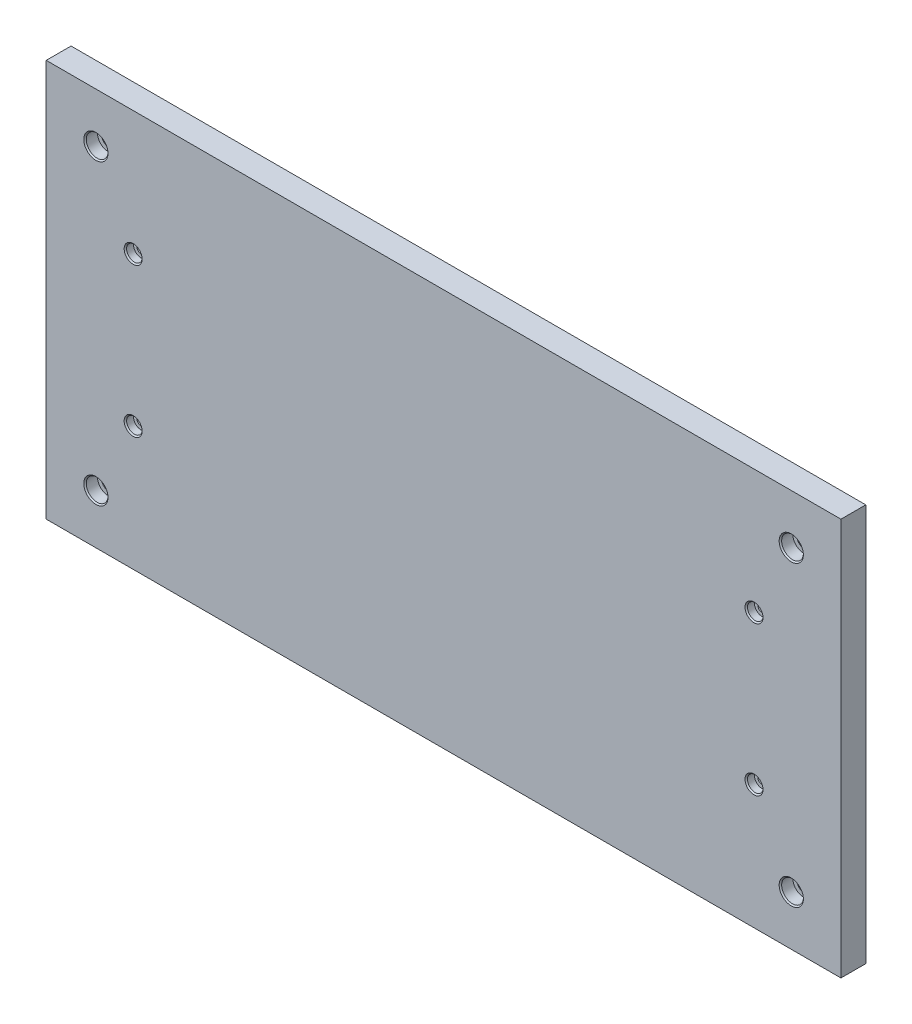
SolidWorks part; units mm, degrees
ref_plane "Front Plane" through (0, 0, 0) normal (0, 0, 1) x (1, 0, 0)
ref_plane "Top Plane" through (0, 0, 0) normal (0, 1, 0) x (1, 0, 0)
ref_plane "Right Plane" through (0, 0, 0) normal (1, 0, 0) x (0, 0, -1)
sketch "Sketch1" plane through (0, 0, 0) normal (0, 0, 1) x (1, 0, 0)
  line L1 (-107.3322, -40.2352) -> (299.0678, -40.2352)
  line L2 (-107.3322, -40.2352) -> (-107.3322, -243.4352)
  line L3 (-107.3322, -243.4352) -> (299.0678, -243.4352)
  line L4 (299.0678, -40.2352) -> (299.0678, -243.4352)
extrude "Boss-Extrude1" add sketch "Sketch1" along normal blind 12.7
hole_wizard "CBORE for 1/4 Socket Head Cap Screw1" positions "Sketch2" profile "Sketch3" counterbore size "1/4" standard "ANSI Inch"
sketch "Sketch2" plane through (0, 0, 12.7) normal (0, 0, 1) x (1, 0, 0)
  line L0 (299.0678, -40.2352) -> (-107.3322, -40.2352) construction
  line L1 (-107.3322, -40.2352) -> (-107.3322, -243.4352) construction
  line L2 (-107.3322, -243.4352) -> (299.0678, -243.4352) construction
  line L3 (299.0678, -243.4352) -> (299.0678, -40.2352) construction
  point P0 (-81.9322, -65.6352)
  point P2 (-81.9322, -218.0352)
  point P4 (273.6678, -218.0352)
  point P6 (273.6678, -65.6352)
  dimension "D1" = 25.4
  dimension "D2" = 25.4
  dimension "D3" = 25.4
  dimension "D4" = 25.4
  dimension "D5" = 25.4
  dimension "D6" = 25.4
  dimension "D7" = 25.4
  dimension "D8" = 25.4
sketch "Sketch3" plane through (-81.9322, -65.6352, 12.7) normal (1, 0, 0) x (0, -1, 0)
  line L0 (0, 0) -> (0, 12.7)
  line L1 (0, 12.7) -> (3.3782, 12.7)
  line L3 (3.3782, 12.7) -> (3.3782, 6.35)
  line L4 (5.5562, 6.35) -> (3.3782, 6.35)
  line L5 (5.5562, 6.35) -> (5.5562, 0.635)
  line L6 (5.5562, 0.635) -> (6.1913, 0)
  line L7 (6.1913, 0) -> (0, 0)
  line L8 (-5.5562, 0.635) -> (-6.1913, 0) construction
  line L11 (0, -6.35) -> (0, 107.95) construction
  dimension "Thru Hole Dia." = 6.7564
  dimension "Thru Hole Depth" = 12.7
  dimension "C'Bore Dia." = 11.1125
  dimension "C'Bore Depth" = 6.35
  dimension "Near C'Sink Dia." = 12.3825
  dimension "Near C'Sink Angle" = 90
hole_wizard "CBORE for #8 Socket Head Cap Screw1" positions "Sketch4" profile "Sketch5" counterbore size "#8" standard "ANSI Inch"
sketch "Sketch4" plane through (0, 0, 12.7) normal (0, 0, 1) x (1, 0, 0)
  line L0 (299.0678, -40.2352) -> (-107.3322, -40.2352) construction
  line L1 (-107.3322, -40.2352) -> (-107.3322, -243.4352) construction
  point P0 (-62.8822, -103.7352)
  dimension "D1" = 63.5
  dimension "D2" = 44.45
sketch "Sketch5" plane through (-62.8822, -103.7352, 12.7) normal (1, 0, 0) x (0, -1, 0)
  line L0 (0, 0) -> (0, 11.5107)
  line L1 (0, 11.5107) -> (2.2479, 10.16)
  line L2 (2.2479, 10.16) -> (2.2479, 4.1656)
  line L3 (2.2479, 4.1656) -> (3.9687, 4.1656)
  line L5 (3.9687, 4.1656) -> (3.9687, 0.635)
  line L6 (3.9687, 0.635) -> (4.6037, 0)
  line L7 (4.6037, 0) -> (0, 0)
  line L8 (-3.9687, 0.635) -> (-4.6037, 0) construction
  line L10 (0, 11.5107) -> (-2.2479, 10.16) construction
  line L11 (0, -6.35) -> (0, 107.95) construction
  dimension "Hole Dia." = 4.4958
  dimension "Hole Depth" = 10.16
  dimension "C'Bore Dia." = 7.9375
  dimension "C'Bore Depth" = 4.1656
  dimension "Near C'Sink Dia." = 9.2075
  dimension "Near C'Sink Angle" = 90
  dimension "Drill Angle" = 118
hole_wizard "CBORE for #8 Socket Head Cap Screw2" positions "Sketch6" profile "Sketch7" counterbore size "#8" standard "ANSI Inch"
sketch "Sketch6" plane through (0, 0, 12.7) normal (0, 0, 1) x (1, 0, 0)
  line L0 (-107.3322, -40.2352) -> (-107.3322, -243.4352) construction
  line L1 (-107.3322, -243.4352) -> (299.0678, -243.4352) construction
  line L2 (299.0678, -40.2352) -> (-107.3322, -40.2352) construction
  line L3 (299.0678, -243.4352) -> (299.0678, -40.2352) construction
  point P0 (-62.8822, -179.9352)
  point P2 (254.6178, -103.7352)
  point P4 (254.6178, -179.9352)
  dimension "D1" = 44.45
  dimension "D2" = 63.5
  dimension "D3" = 63.5
  dimension "D4" = 44.45
  dimension "D5" = 44.45
  dimension "D6" = 63.5
sketch "Sketch7" plane through (-62.8822, -179.9352, 12.7) normal (1, 0, 0) x (0, -1, 0)
  line L0 (0, 0) -> (0, 11.5107)
  line L1 (0, 11.5107) -> (2.2479, 10.16)
  line L2 (2.2479, 10.16) -> (2.2479, 4.1656)
  line L3 (2.2479, 4.1656) -> (3.9687, 4.1656)
  line L5 (3.9687, 4.1656) -> (3.9687, 0.635)
  line L6 (3.9687, 0.635) -> (4.6037, 0)
  line L7 (4.6037, 0) -> (0, 0)
  line L8 (-3.9687, 0.635) -> (-4.6037, 0) construction
  line L10 (0, 11.5107) -> (-2.2479, 10.16) construction
  line L11 (0, -6.35) -> (0, 107.95) construction
  dimension "Hole Dia." = 4.4958
  dimension "Hole Depth" = 10.16
  dimension "C'Bore Dia." = 7.9375
  dimension "C'Bore Depth" = 4.1656
  dimension "Near C'Sink Dia." = 9.2075
  dimension "Near C'Sink Angle" = 90
  dimension "Drill Angle" = 118
